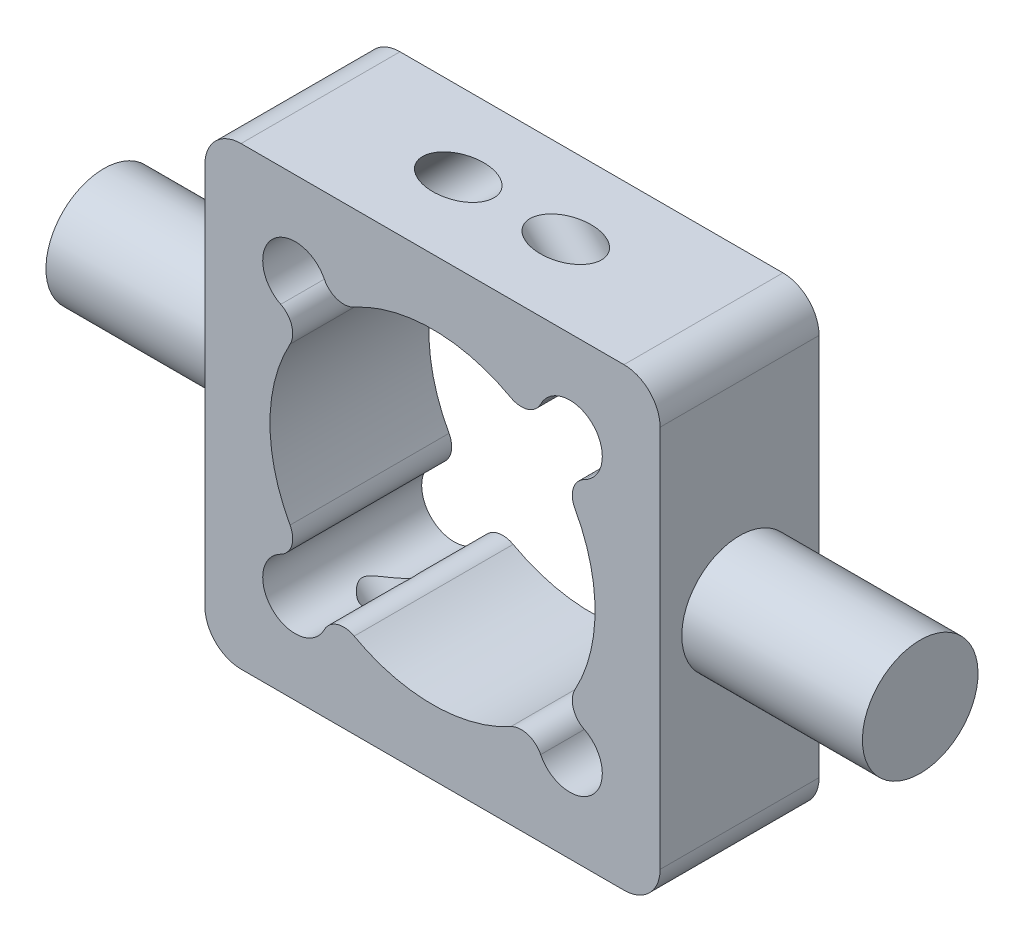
SolidWorks part; units mm, degrees
ref_plane "Plano frontal" through (0, 0, 0) normal (0, 0, 1) x (1, 0, 0)
ref_plane "Plano superior" through (0, 0, 0) normal (0, 1, 0) x (1, 0, 0)
ref_plane "Plano direito" through (0, 0, 0) normal (1, 0, 0) x (0, 0, -1)
sketch "Esboço1" plane through (0, 0, 0) normal (0, 0, 1) x (1, 0, 0)
  line L0 (0, 24.4094) -> (0, -31.769) construction
  line L1 (-31.5, 31.5) -> (31.5, 31.5)
  line L2 (-31.5, 31.5) -> (-31.5, -31.5)
  line L3 (-31.5, -31.5) -> (31.5, -31.5)
  line L4 (31.5, 31.5) -> (31.5, -31.5)
  line L5 (-35.6169, 0) -> (36.185, 0) construction
  arc A0 (-19.7158, 10.8415) -> (-19.7158, -10.8415) centre (0, 0) ccw
  arc A1 (-14.9722, 21.0067) -> (-21.0067, 14.9722) centre (-19, 19) ccw
  arc A2 (21.0067, 14.9722) -> (14.9722, 21.0067) centre (19, 19) ccw
  arc A3 (14.9722, -21.0067) -> (21.0067, -14.9722) centre (19, -19) ccw
  arc A4 (-21.0067, -14.9722) -> (-14.9722, -21.0067) centre (-19, -19) ccw
  arc A5 (10.8415, 19.7158) -> (-10.8415, 19.7158) centre (0, 0) ccw
  arc A6 (19.7158, -10.8415) -> (19.7158, 10.8415) centre (0, 0) ccw
  arc A7 (-10.8415, -19.7158) -> (10.8415, -19.7158) centre (0, 0) ccw
  arc A8 (-14.9722, 21.0067) -> (-10.8415, 19.7158) centre (-12.287, 22.3446) ccw
  arc A9 (-19.7158, 10.8415) -> (-21.0067, 14.9722) centre (-22.3446, 12.287) ccw
  arc A10 (-10.8415, -19.7158) -> (-14.9722, -21.0067) centre (-12.287, -22.3446) ccw
  arc A11 (-21.0067, -14.9722) -> (-19.7158, -10.8415) centre (-22.3446, -12.287) ccw
  arc A12 (10.8415, -19.7158) -> (14.9722, -21.0067) centre (12.287, -22.3446) cw
  arc A13 (19.7158, -10.8415) -> (21.0067, -14.9722) centre (22.3446, -12.287) ccw
  arc A14 (19.7158, 10.8415) -> (21.0067, 14.9722) centre (22.3446, 12.287) cw
  arc A15 (10.8415, 19.7158) -> (14.9722, 21.0067) centre (12.287, 22.3446) ccw
  point P28 (-15.2002, -16.5892)
  point P35 (16.5892, -15.2002)
  point P40 (15.2002, 16.5892)
  dimension "D2" = 45
  dimension "D4" = 9
  dimension "D6" = 3
  dimension "D1" = 63
  dimension "D3" = 38
  dimension "D5" = 38
extrude "Extrusão1" add sketch "Esboço1" along normal blind 22
sketch "Esboço2" plane through (-31.5, 0, 0) normal (-1, 0, 0) x (0, 0, 1)
  line L0 (11, 31.5) -> (11, -31.5) construction
  line L1 (22, 31.5) -> (0, 31.5) construction
  line L2 (22, -31.5) -> (0, -31.5) construction
  line L3 (0, 0) -> (22, 0) construction
  line L4 (0, 31.5) -> (0, -31.5) construction
  line L5 (22, 31.5) -> (22, -31.5) construction
  circle A0 centre (11, 0) radius 8
  dimension "D1" = 16
extrude "Extrusão2" add sketch "Esboço2" along normal blind 25
mirror "Espelhar1" about plane through (0, 0, 0) normal (1, 0, 0) of "Extrusão2"
fillet "Filete2" radius 5 4 edges at (-31.5, 31.5, 11) (31.5, 31.5, 11) (31.5, -31.5, 11) (-31.5, -31.5, 11)
ref_plane "Plano1" through (0, 0, 0) normal (1, 0, 0) x (0, 0, -1)
ref_plane "Plano2" through (3.0173, -3.0173, 0) normal (0.7071, -0.7071, 0) x (0.7071, 0.7071, 0)
ref_plane "Plano3" through (-18.1959, 18.1959, 0) normal (0.7071, -0.7071, 0) x (0.7071, 0.7071, 0)
sketch "Esboço6" plane through (-18.1959, 18.1959, 0) normal (0.7071, -0.7071, 0) x (0.7071, 0.7071, 0)
  line L0 (31.9952, 11) -> (-1.9393, 11) construction
  line L1 (41.0122, 0) -> (3.5355, 0) construction
  line L2 (41.0122, 22) -> (3.5355, 22) construction
  line L3 (3.5355, 0) -> (3.5355, 22) construction
  circle A0 centre (27.5355, 11) radius 3.5
  dimension "D1" = 7
  dimension "D2" = 24
extrude "Extrusão5" cut sketch "Esboço6" along normal blind 25
mirror "Espelhar2" about plane through (0, 0, 0) normal (1, 0, 0) of "Extrusão5"
mirror "Espelhar3" about plane through (0, 0, 0) normal (0, 1, 0) of "Espelhar2", "Extrusão5"
